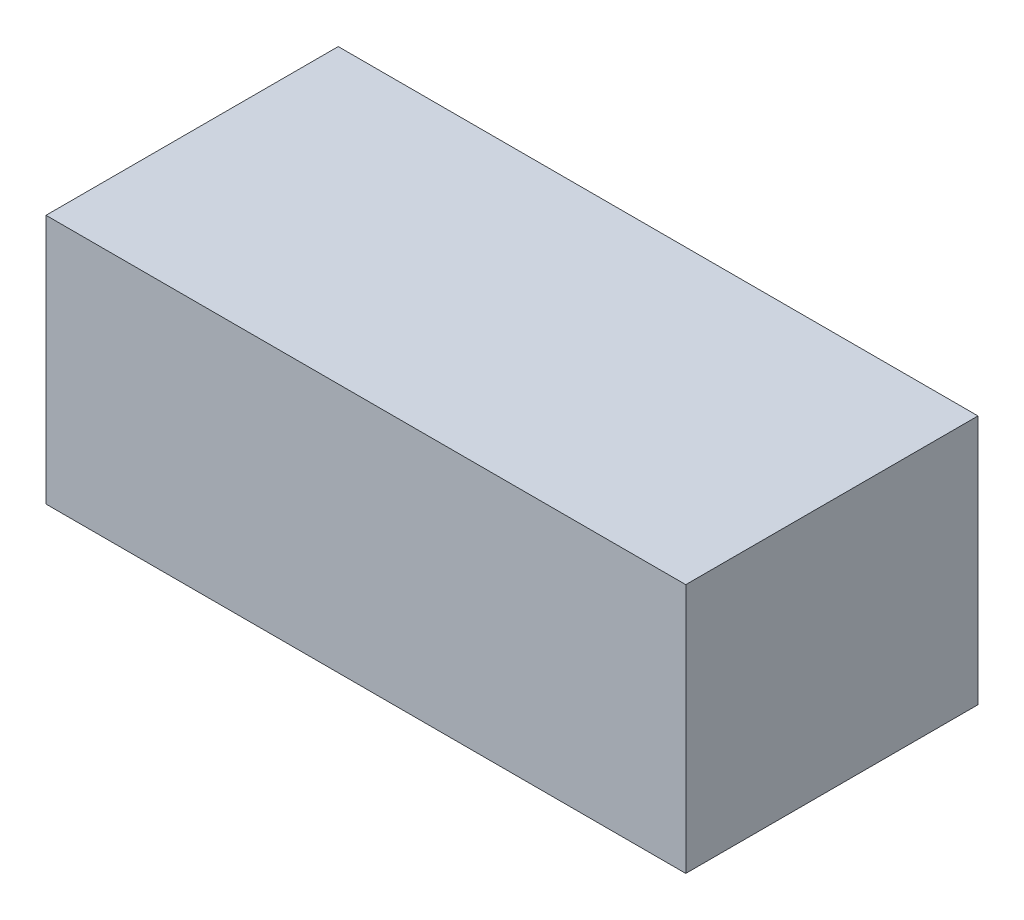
SolidWorks part; units mm, degrees
ref_plane "Front Plane" through (0, 0, 0) normal (0, 0, 1) x (1, 0, 0)
ref_plane "Top Plane" through (0, 0, 0) normal (0, 1, 0) x (1, 0, 0)
ref_plane "Right Plane" through (0, 0, 0) normal (1, 0, 0) x (0, 0, -1)
sketch "Sketch1" plane through (0, 0, 0) normal (0, 1, 0) x (1, 0, 0)
  line L1 (0, 0) -> (24.3, 0)
  line L2 (0, 0) -> (0, 11.1)
  line L3 (0, 11.1) -> (24.3, 11.1)
  line L4 (24.3, 0) -> (24.3, 11.1)
  dimension "D1" = 24.3
  dimension "D2" = 11.1
extrude "Extrude1" add sketch "Sketch1" along normal blind 9.5
